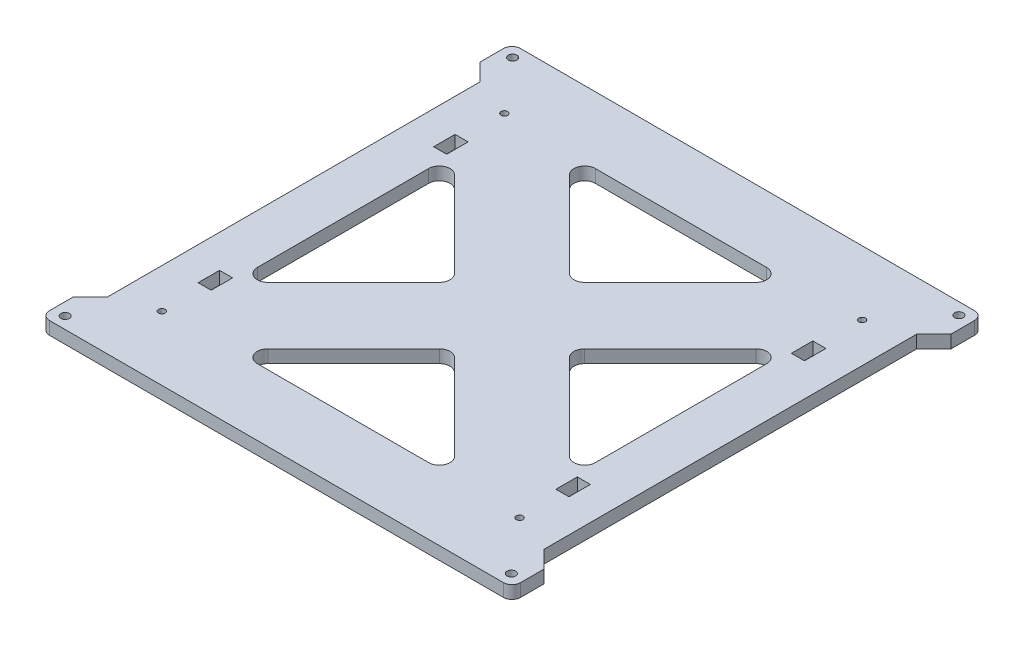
SolidWorks part; units mm, degrees
ref_plane "Спереди" through (0, 0, 0) normal (0, 0, 1) x (1, 0, 0)
ref_plane "Сверху" through (0, 0, 0) normal (0, 1, 0) x (1, 0, 0)
ref_plane "Справа" through (0, 0, 0) normal (1, 0, 0) x (0, 0, -1)
sketch "Эскиз1" plane through (0, 0, 0) normal (0, 1, 0) x (1, 0, 0)
  line L0 (110, 95) -> (102, 87)
  line L1 (-110, -110) -> (110, -110)
  line L2 (-110, -110) -> (-110, -95)
  line L3 (-110, 110) -> (110, 110)
  line L4 (110, -110) -> (110, -95)
  line L5 (-110, -110) -> (110, 110) construction
  line L6 (-110, 110) -> (110, -110) construction
  line L7 (102, 87) -> (102, -87)
  line L8 (102, -87) -> (110, -95)
  line L9 (110, 95) -> (110, 110)
  line L10 (0, 148.6758) -> (0, 0) construction
  line L11 (0, 0) -> (127.8322, 0) construction
  line L12 (-110, 95) -> (-102, 87)
  line L13 (-102, -87) -> (-110, -95)
  line L14 (-102, 87) -> (-102, -87)
  line L15 (-110, 95) -> (-110, 110)
  line L16 (-40, 78.9411) -> (40, 78.9411)
  line L17 (43.5355, 70.4056) -> (3.5355, 30.4056)
  line L18 (-43.5355, 70.4056) -> (-3.5355, 30.4056)
  line L19 (78.9411, 40) -> (78.9411, -40)
  line L20 (70.4056, 43.5355) -> (30.4056, 3.5355)
  line L21 (70.4056, -43.5355) -> (30.4056, -3.5355)
  line L22 (40, -78.9411) -> (-40, -78.9411)
  line L23 (43.5355, -70.4056) -> (3.5355, -30.4056)
  line L24 (-43.5355, -70.4056) -> (-3.5355, -30.4056)
  line L25 (-78.9411, -40) -> (-78.9411, 40)
  line L26 (-70.4056, -43.5355) -> (-30.4056, -3.5355)
  line L27 (-70.4056, 43.5355) -> (-30.4056, 3.5355)
  line L28 (86.6, -60) -> (86.6, -50)
  line L29 (80.5, 60) -> (86.6, 60)
  line L30 (80.5, 60) -> (80.5, 50)
  line L31 (80.5, 50) -> (86.6, 50)
  line L32 (86.6, 60) -> (86.6, 50)
  line L33 (80.5, -50) -> (86.6, -50)
  line L34 (80.5, -60) -> (80.5, -50)
  line L35 (80.5, -60) -> (86.6, -60)
  line L36 (-80.5, -60) -> (-86.6, -60)
  line L37 (-80.5, -60) -> (-80.5, -50)
  line L38 (-80.5, -50) -> (-86.6, -50)
  line L39 (-86.6, -60) -> (-86.6, -50)
  line L40 (-86.6, 60) -> (-86.6, 50)
  line L41 (-80.5, 50) -> (-86.6, 50)
  line L42 (-80.5, 60) -> (-80.5, 50)
  line L43 (-80.5, 60) -> (-86.6, 60)
  arc A0 (40, 78.9411) -> (43.5355, 70.4056) centre (40, 73.9411) cw
  arc A1 (3.5355, 30.4056) -> (-3.5355, 30.4056) centre (0, 33.9411) cw
  arc A2 (-43.5355, 70.4056) -> (-40, 78.9411) centre (-40, 73.9411) cw
  arc A3 (70.4056, 43.5355) -> (78.9411, 40) centre (73.9411, 40) cw
  arc A4 (78.9411, -40) -> (70.4056, -43.5355) centre (73.9411, -40) cw
  arc A5 (30.4056, -3.5355) -> (30.4056, 3.5355) centre (33.9411, 0) cw
  arc A6 (43.5355, -70.4056) -> (40, -78.9411) centre (40, -73.9411) cw
  arc A7 (-40, -78.9411) -> (-43.5355, -70.4056) centre (-40, -73.9411) cw
  arc A8 (-3.5355, -30.4056) -> (3.5355, -30.4056) centre (0, -33.9411) cw
  arc A9 (-70.4056, -43.5355) -> (-78.9411, -40) centre (-73.9411, -40) cw
  arc A10 (-78.9411, 40) -> (-70.4056, 43.5355) centre (-73.9411, 40) cw
  arc A11 (-30.4056, 3.5355) -> (-30.4056, -3.5355) centre (-33.9411, 0) cw
  circle A12 centre (104.2, 104.5) radius 2
  circle A13 centre (-104.2, 104.5) radius 2
  circle A14 centre (104.2, -104.5) radius 2
  circle A15 centre (-104.2, -104.5) radius 2
  point P0 (0, 0)
  point P21 (0, 78.9411)
  point P23 (52.0711, 78.9411)
  point P26 (0, 26.8701)
  point P29 (-52.0711, 78.9411)
  point P60 (0, 0)
  dimension "D3" = 5
  dimension "D8" = 4
  dimension "D1" = 220
  dimension "D2" = 220
  dimension "D5" = 10
  dimension "D6" = 6.1
  dimension "D7" = 208.4
  dimension "D9" = 209
  dimension "D10" = 161
  dimension "D11" = 100
  dimension "D12" = 80
  dimension "D13" = 38
  dimension "D14" = 8
  dimension "D15" = 15
  dimension "D16" = 45
  dimension "D4" = 4
extrude "Бобышка-Вытянуть1" add sketch "Эскиз1" along normal blind 6
sketch "Эскиз2" plane through (0, 6, 0) normal (0, 1, 0) x (1, 0, 0)
  line L0 (0, 133.5509) -> (0, 0) construction
  line L1 (0, 0) -> (173.2301, 0) construction
  line L2 (83.55, 0) -> (83.55, 60) construction
  line L3 (86.6, 60) -> (80.5, 60) construction
  circle A0 centre (83.55, 80) radius 1.55
  circle A1 centre (83.55, -80) radius 1.55
  circle A2 centre (-83.55, -80) radius 1.55
  circle A3 centre (-83.55, 80) radius 1.55
  dimension "D1" = 3.1
  dimension "D2" = 80
extrude "Вырез-Вытянуть1" cut sketch "Эскиз2" against normal through all
fillet "Скругление1" radius 4 4 edges at (-110, 3, 110) (110, 3, 110) (110, 3, -110) (-110, 3, -110)
